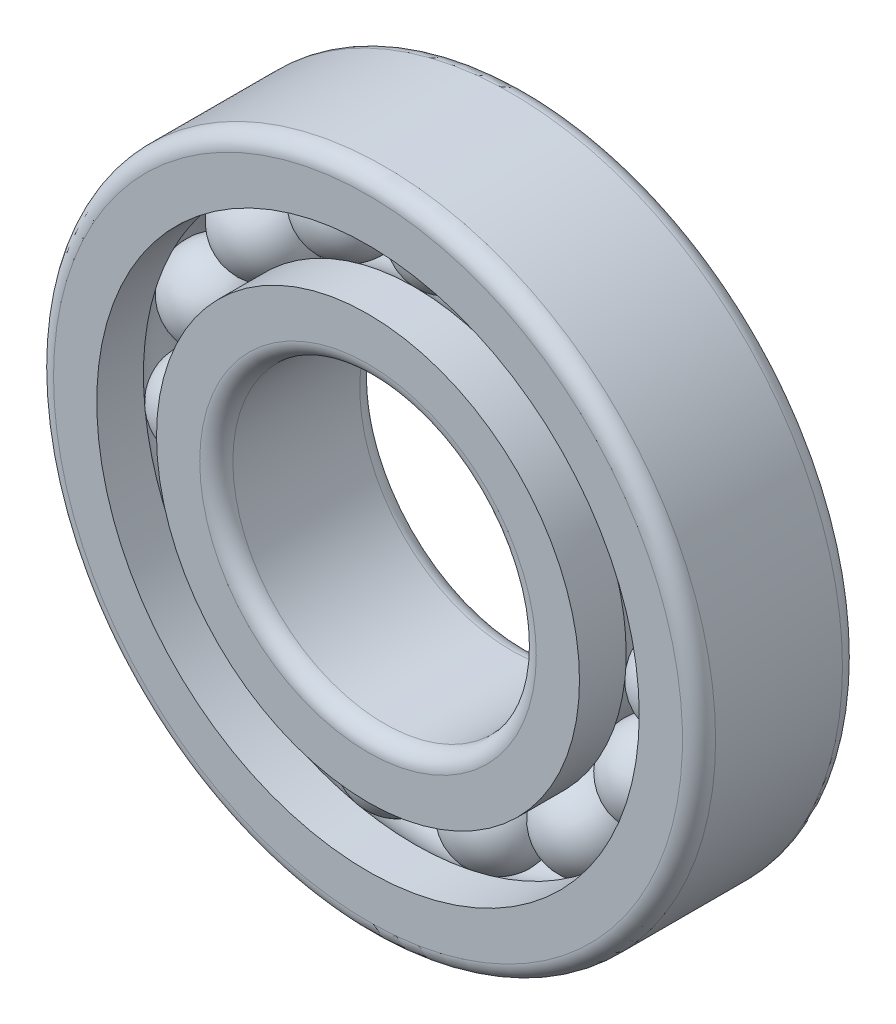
SolidWorks part; units mm, degrees
ref_plane "Front Plane" through (0, 0, 0) normal (0, 0, 1) x (1, 0, 0)
ref_plane "Top Plane" through (0, 0, 0) normal (0, 1, 0) x (1, 0, 0)
ref_plane "Right Plane" through (0, 0, 0) normal (1, 0, 0) x (0, 0, -1)
other "Configuration Table"
sketch "BaseSke" plane through (0, 0, 0) normal (1, 0, 0) x (0, 0, -1)
  line L0 (-47.2296, 0) -> (24.6132, 0) construction
  line L1 (-47.2296, 43.75) -> (24.6132, 43.75) construction
  line L2 (0, 129.5214) -> (0, -86.3012) construction
  line L3 (0, 51.875) -> (0, 35.625)
  line L4 (-14.5, 60) -> (14.5, 60) construction
  line L5 (-14.5, 27.5) -> (14.5, 27.5) construction
  arc A0 (0, 51.875) -> (0, 35.625) centre (0, 43.75) ccw
revolve "Ball" add sketch "BaseSke" angle 360 about L3
sketch "OuterRaceSke" plane through (0, 0, 0) normal (1, 0, 0) x (0, 0, -1)
  line L0 (0, 0) -> (0, 87.5396) construction
  line L1 (-14.5, 60) -> (14.5, 60)
  line L2 (-14.5, 60) -> (-14.5, 49.1667)
  line L3 (-14.5, 49.1667) -> (-6.0426, 49.1667)
  line L4 (14.5, 60) -> (14.5, 49.1667)
  line L5 (-50.3916, 0) -> (55.2197, 0) construction
  line L6 (-47.2296, 43.75) -> (24.6132, 43.75) construction
  line L7 (6.0426, 49.1667) -> (14.5, 49.1667)
  arc A0 (6.0426, 49.1667) -> (-6.0426, 49.1667) centre (0, 43.75) ccw
revolve "OuterRace" add sketch "OuterRaceSke" angle 360 about L5
sketch "InnerRaceSke" plane through (0, 0, 0) normal (1, 0, 0) x (0, 0, -1)
  line L0 (-70.8626, 0) -> (113.5527, 0) construction
  line L1 (0, 58.441) -> (0, -70.8113) construction
  line L2 (-14.5, 27.5) -> (14.5, 27.5)
  line L3 (-14.5, 27.5) -> (-14.5, 38.3333)
  line L4 (-14.5, 38.3333) -> (-6.0426, 38.3333)
  line L5 (14.5, 27.5) -> (14.5, 38.3333)
  line L6 (0, 129.5214) -> (0, -86.3012) construction
  line L7 (6.0426, 38.3333) -> (14.5, 38.3333)
  arc A0 (-6.0426, 38.3333) -> (6.0426, 38.3333) centre (0, 43.75) ccw
  arc A1 (0, 51.875) -> (0, 35.625) centre (0, 43.75) ccw construction
revolve "InnerRace" add sketch "InnerRaceSke" angle 360 about L0
fillet "Fillet1" radius 3 4 edges at (27.5, 0, -14.5) (27.5, 0, 14.5) (60, 0, -14.5) (60, 0, 14.5)
sketch "ShieldedSke" plane through (0, 0, 0) normal (1, 0, 0) x (0, 0, -1)
  line L1 (-13, 49.1667) -> (-9.6667, 49.1667)
  line L2 (-14.5, 47.6667) -> (-14.5, 39.8333)
  line L3 (-13, 38.3333) -> (-9.6667, 38.3333)
  line L4 (-9.6667, 49.1667) -> (-9.6667, 38.3333)
  arc A0 (-13, 49.1667) -> (-14.5, 47.6667) centre (-13, 47.6667) ccw
  arc A1 (-14.5, 39.8333) -> (-13, 38.3333) centre (-13, 39.8333) ccw
  point P12 (-14.5, 49.1667)
  point P13 (-14.5, 38.3333)
revolve "Shielded" [suppressed] add sketch "ShieldedSke" angle 360 about L0
mirror "DoubleShielded" [suppressed] about plane through (0, 0, 0) normal (0, 0, 1)
sketch "SealedSke" plane through (0, 0, 0) normal (1, 0, 0) x (0, 0, -1)
  line L0 (-34.5153, 0) -> (39.09, 0) construction
  line L1 (-31.6, 38.3333) -> (-11.6, 38.3333)
  line L2 (-31.6, 38.3333) -> (-31.6, 49.1667)
  line L3 (-31.6, 49.1667) -> (-11.6, 49.1667)
  line L4 (-11.6, 38.3333) -> (-11.6, 49.1667)
revolve "Sealed" [suppressed] cut sketch "SealedSke" angle 360 about L0
mirror "DoubleSealed" [suppressed] about plane through (0, 0, 0) normal (0, 0, 1)
pattern_circular "CirPatternBall" count 15 over 360 about axis through (0, 0, 0) along (0, 0, 1) of "Ball"
sketch "CutGrooveSke" plane through (0, 0, 0) normal (1, 0, 0) x (0, 0, -1)
  line L0 (-51.8407, 0) -> (83.8302, 0) construction
  line L1 (8.7, -78.8) -> (7.25, -78.8)
  line L2 (8.7, -78.8) -> (8.7, -58.8)
  line L3 (8.7, -58.8) -> (7.25, -58.8)
  line L4 (7.25, -78.8) -> (7.25, -58.8)
revolve "CutGroove" [suppressed] cut sketch "CutGrooveSke" angle 360 about L0
sketch "TaperSke" plane through (0, 0, 0) normal (1, 0, 0) x (0, 0, -1)
  line L0 (-14.5, 27.5) -> (14.5, 27.5)
  line L1 (14.5, 27.5) -> (14.5, 29.9167)
  line L2 (14.5, 29.9167) -> (-14.5, 27.5)
  line L7 (-41.2502, 0) -> (40.8606, 0) construction
revolve "Taper" [suppressed] cut sketch "TaperSke" angle 360 about L7
fillet "Fillet2" [suppressed] radius 3
sketch "SimplifiedSke" plane through (0, 0, 0) normal (1, 0, 0) x (0, 0, -1)
  line L0 (37.5911, 0) -> (-37.5911, 0) construction
  circle A0 centre (0, 43.75) radius 8.125
  arc A1 (0, 51.875) -> (0, 35.625) centre (0, 43.75) ccw construction
revolve "Simplified" [suppressed] add sketch "SimplifiedSke" angle 360 about L0
equation "\"D1@BaseSke\" =  (\"Bearing_Outside_Diameter@BaseSke\"  +  \"Bearing_Inside_Diameter@BaseSke\"  )  / 4"
equation "\"Ball_diameter@BaseSke\" =  ( \"Bearing_Outside_Diameter@BaseSke\" - \"Bearing_Inside_Diameter@BaseSke\" ) / 4 "
equation "\"D2@OuterRaceSke\" = \"Bearing_Outside_Diameter@BaseSke\" -  ( \"Bearing_Outside_Diameter@BaseSke\" - \"Bearing_Inside_Diameter@BaseSke\" )  / 3"
equation "\"D4@OuterRaceSke\" = (  \"Bearing_Outside_Diameter@BaseSke\" - \"Bearing_Inside_Diameter@BaseSke\" ) / 4 -0.02"
equation "\"D1@InnerRaceSke\" = \"Bearing_Inside_Diameter@BaseSke\" +  ( \"Bearing_Outside_Diameter@BaseSke\" - \"Bearing_Inside_Diameter@BaseSke\" )  / 3"
equation "\"D2@InnerRaceSke\" = \"D4@OuterRaceSke\""
equation "\"D1@ShieldedSke\" = \"Fillet_radius@Fillet1\"/2"
equation "\"D2@ShieldedSke\" = \"Bearing_Thickness@BaseSke\"/3"
equation "\"D2@SealedSke\" = \"Bearing_Thickness@BaseSke\"/2.5"
equation "\"D1@CirPatternBall\" = int( \"D1@BaseSke\"* pi  * 2 / \"Ball_diameter@BaseSke\" ) -1"
equation "\"D1@CutGrooveSke\" = \"Bearing_Outside_Diameter@BaseSke\" * 0.49"
equation "\"D2@CutGrooveSke\" = \"Bearing_Thickness@BaseSke\" *0.25"
equation "\"D3@CutGrooveSke\" = \"Bearing_Thickness@BaseSke\"/20"
equation "\"Taper@TaperSke\" = \"Bearing_Thickness@BaseSke\"/12"
equation "\"D1@Fillet2\" = \"Fillet_radius@Fillet1\""
